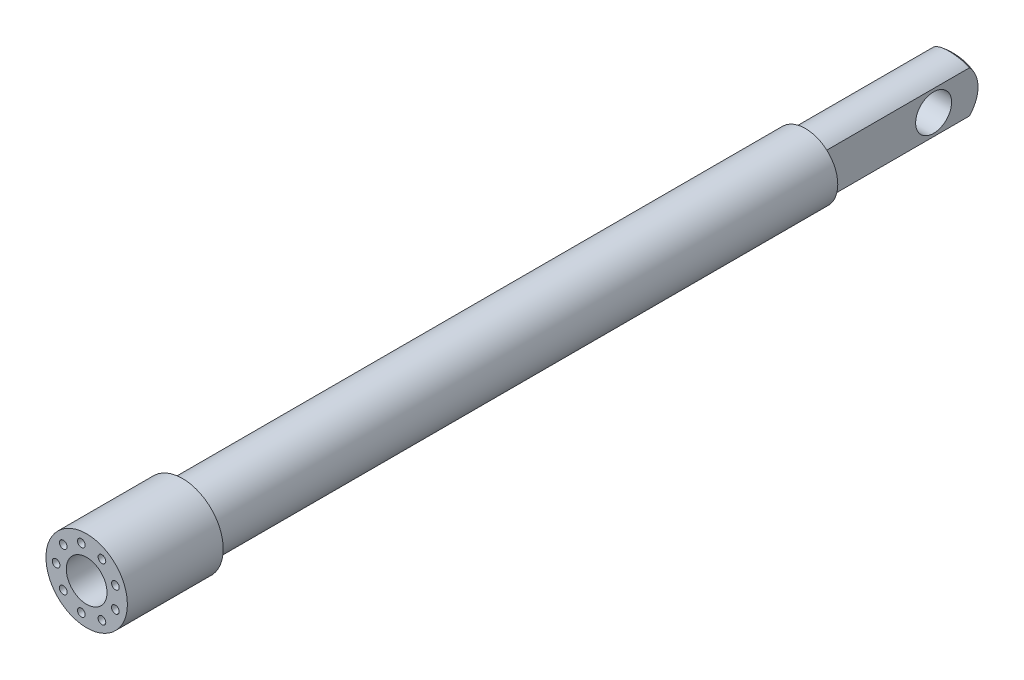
SolidWorks part; units mm, degrees
ref_plane "Front" through (0, 0, 0) normal (0, 0, 1) x (1, 0, 0)
ref_plane "Top" through (0, 0, 0) normal (0, 1, 0) x (1, 0, 0)
ref_plane "Right" through (0, 0, 0) normal (1, 0, 0) x (0, 0, -1)
sketch "Sketch1" plane through (0, 0, 0) normal (0, 0, 1) x (1, 0, 0)
  circle A0 centre (0, 0) radius 85
  dimension "D1" = 170
extrude "Extrude1" add sketch "Sketch1" against normal blind 200
sketch "Sketch2" plane through (0, 0, 0) normal (0, 0, 1) x (1, 0, 0)
  circle A1 centre (0, 0) radius 67.5
  dimension "D1" = 135
extrude "Extrude2" add sketch "Sketch2" against normal blind 1500
sketch "Sketch3" plane through (0, 0, 0) normal (0, 0, 1) x (1, 0, 0)
  circle A0 centre (0, 0) radius 42.5
  dimension "D1" = 85
extrude "Cut-Extrude1" cut sketch "Sketch3" against normal offset from surface (1470 mm away) 30
sketch "Sketch5" plane through (0, 0, 0) normal (0, 0, 1) x (1, 0, 0)
  line L0 (0, 0) -> (-63.75, 0) construction
  circle A0 centre (-63.75, 0) radius 8
  dimension "D2" = 16
  dimension "D1" = 63.75
extrude "Cut-Extrude2" cut sketch "Sketch5" against normal blind 85
pattern_circular "CirPattern1" count 9 every 40
sketch "Sketch12" plane through (0, 0, -1500) normal (0, 0, -1) x (-1, 0, 0)
  circle A2 centre (0, 0) radius 57.5
  circle A3 centre (0, 0) radius 57.5
  dimension "D1" = 10
extrude "Extrude3" add sketch "Sketch12" along normal blind 350
sketch "Sketch14" plane through (0, 0, 0) normal (0, 1, 0) x (1, 0, 0)
  line L0 (37.5, 1500) -> (37.5, 1850)
  line L1 (57.5, 1850) -> (37.5, 1850)
  line L2 (37.5, 1500) -> (57.5, 1500)
  line L3 (57.5, 1500) -> (57.5, 1850) construction
  line L4 (57.5, 1500) -> (57.5, 1850)
  line L5 (0, 1857.3677) -> (0, 1270.3814) construction
  line L6 (0, 200) -> (0, 0) construction
  line L7 (-57.5, 1500) -> (-57.5, 1850)
  line L8 (-37.5, 1500) -> (-57.5, 1500)
  line L9 (-57.5, 1850) -> (-37.5, 1850)
  line L10 (-37.5, 1500) -> (-37.5, 1850)
  dimension "D1" = 20
extrude "Cut-Extrude3" cut sketch "Sketch14" against normal mid plane 350
sketch "Sketch16" plane through (37.5, 0, 0) normal (1, 0, 0) x (0, 0, -1)
  line L3 (1850, 0) -> (1730, 0) construction
  line L8 (1850, 0) -> (1500, 0) construction
  line L9 (1850, -43.589) -> (1850, 43.589) construction
  circle A0 centre (1730, 0) radius 37.5
  dimension "D1" = 120
  dimension "D2" = 75
extrude "Cut-Extrude5" cut sketch "Sketch16" against normal through all
sketch "Sketch18" plane through (0, 0, 0) normal (1, 0, 0) x (0, 0, -1)
  line L0 (1730, 80) -> (1730, -80) construction
  line L4 (1850, 0) -> (1500, 0) construction
  line L11 (1730, 80) -> (1730, 97.5)
  line L12 (1730, -80) -> (1730, -97.5)
  line L16 (1890, -97.5) -> (1890, -43.589)
  line L17 (1890, -43.589) -> (1890, 43.589)
  line L18 (1890, 43.589) -> (1890, 97.5)
  line L19 (1500, -97.5) -> (1890, -97.5)
  line L20 (1890, 97.5) -> (1500, 97.5)
  line L21 (1890, -97.5) -> (1890, -43.589)
  line L22 (1890, -43.589) -> (1890, 43.589)
  line L23 (1890, 43.589) -> (1890, 97.5)
  line L24 (1730, -97.5) -> (1890, -97.5)
  line L25 (1890, 97.5) -> (1730, 97.5)
  ellipse E0 centre (1730, 0) end of major axis (1630, 0) minor radius 80 (1730, -80) -> (1730, 80) ccw
  point P0 (1730, 0)
  dimension "D3" = 40
  dimension "D1" = 160
  dimension "D2" = 200
revolve "Cut-Revolve8" cut sketch "Sketch18" angle 180 about L0
